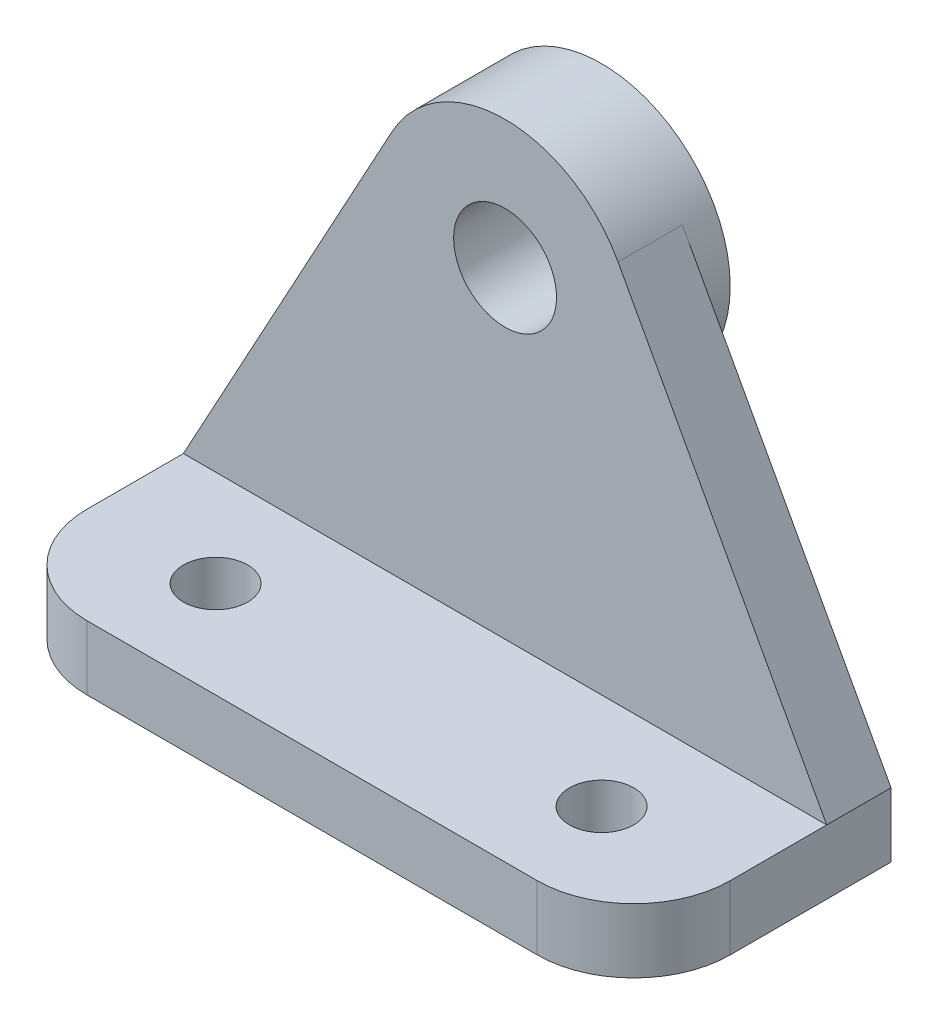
SolidWorks part; units mm, degrees
ref_plane "Front Plane" through (0, 0, 0) normal (0, 0, 1) x (1, 0, 0)
ref_plane "Top Plane" through (0, 0, 0) normal (0, 1, 0) x (1, 0, 0)
ref_plane "Right Plane" through (0, 0, 0) normal (1, 0, 0) x (0, 0, -1)
sketch "Sketch1" plane through (0, 0, 0) normal (0, 1, 0) x (1, 0, 0)
  line L0 (-50, 0) -> (50, 0)
  line L1 (50, 0) -> (50, 40)
  line L2 (50, 40) -> (-50, 40)
  line L3 (-50, 40) -> (-50, 0)
  dimension "D1" = 40
  dimension "D2" = 100
extrude "Boss-Extrude1" add sketch "Sketch1" along normal blind 10
sketch "Sketch2" plane through (0, 0, -40) normal (0, 0, -1) x (-1, 0, 0)
  line L0 (-50, 10) -> (50, 10)
  line L1 (50, 10) -> (17.5647, 69.5647)
  line L2 (-17.5647, 69.5647) -> (-50, 10)
  line L3 (0, 0) -> (0, 60) construction
  arc A0 (17.5647, 69.5647) -> (-17.5647, 69.5647) centre (0, 60) ccw
  circle A1 centre (0, 60) radius 8 construction
  dimension "D1" = 16
  dimension "D2" = 20
  dimension "D3" = 50
extrude "Boss-Extrude2" add sketch "Sketch2" against normal blind 10
sketch "Sketch3" plane through (0, 0, -30) normal (0, 0, 1) x (1, 0, 0)
  line L0 (0, 0) -> (0, 120) construction
  circle A0 centre (0, 60) radius 20
  arc A1 (17.5647, 69.5647) -> (-17.5647, 69.5647) centre (0, 60) ccw construction
extrude "Boss-Extrude3" add sketch "Sketch3" against normal blind 15
sketch "Sketch4" plane through (0, 0, -45) normal (0, 0, -1) x (-1, 0, 0)
  circle A0 centre (0, 60) radius 8
  circle A1 centre (0, 60) radius 20 construction
  dimension "D1" = 16
extrude "Cut-Extrude1" cut sketch "Sketch4" against normal through all
sketch "Sketch5" plane through (0, 0, 0) normal (0, -1, 0) x (1, 0, 0)
  line L0 (50, -40) -> (-50, -40) construction
  circle A0 centre (-30, -15) radius 5
  dimension "D1" = 10
  dimension "D2" = 30
  dimension "D3" = 25
extrude "Cut-Extrude2" cut sketch "Sketch5" against normal through all
mirror "Mirror1" about plane through (0, 0, 0) normal (1, 0, 0) of "Cut-Extrude2"
fillet "Fillet1" radius 15 2 edges at (-50, 5, 0) (50, 5, 0)
